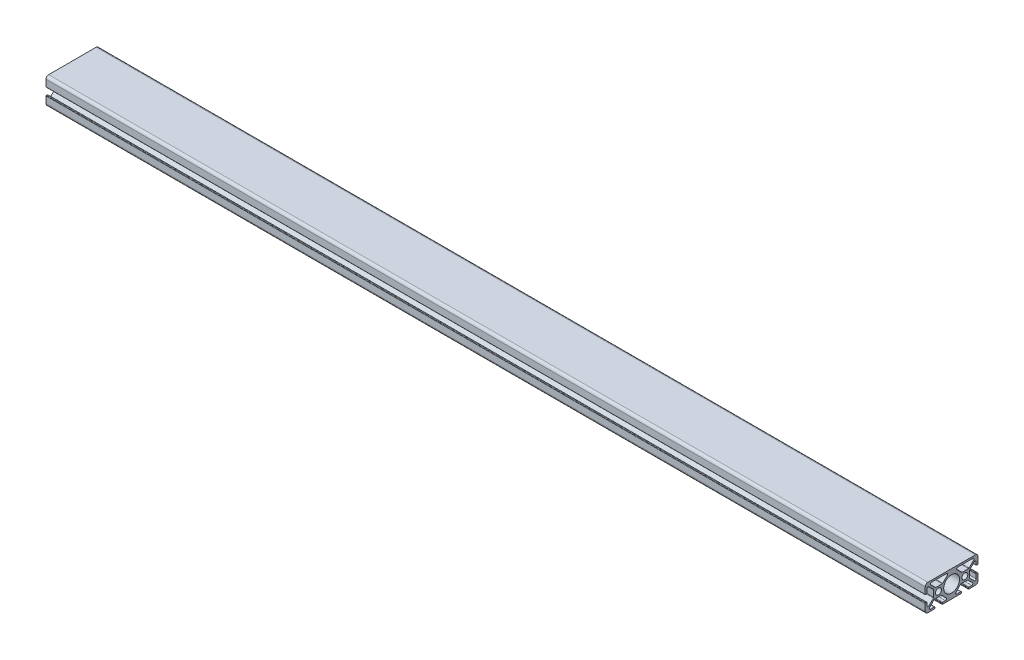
SolidWorks part; units mm, degrees
ref_plane "Ebene vorne" through (0, 0, 0) normal (0, 0, 1) x (1, 0, 0)
ref_plane "Ebene oben" through (0, 0, 0) normal (0, 1, 0) x (1, 0, 0)
ref_plane "Ebene rechts" through (0, 0, 0) normal (1, 0, 0) x (0, 0, -1)
sketch "Skizze1" plane through (0, 0, 0) normal (0, 1, 0) x (1, 0, 0)
  line L0 (0, 0) -> (1000, 0)
  dimension "D1" = 1000
other "Strukturbauteil1"
ref_plane "Ebene1" through (0, 0, 0) normal (1, 0, 0) x (0, 0, -1)
sketch "Model" plane through (0, 0, 0) normal (1, 0, 0) x (0, 0, -1)
  line L0 (25.0199, 10.7846) -> (19.9282, 5.6929)
  line L1 (19.2211, 5.4) -> (11.9789, 5.4)
  line L2 (11.2718, 5.6929) -> (6.1801, 10.7846)
  line L3 (-4.9801, 10.7846) -> (-10.0718, 5.6929)
  line L4 (-10.7789, 5.4) -> (-18.0211, 5.4)
  line L5 (-18.7282, 5.6929) -> (-23.8199, 10.7846)
  line L6 (-22.9023, 13) -> (-5.8977, 13)
  line L7 (7.0977, 13) -> (24.1023, 13)
  line L8 (-29.5, 4) -> (-28.5, 4)
  line L9 (-28, 4.5) -> (-28, 9.1023)
  line L10 (-25.7846, 10.0199) -> (-20.6929, 4.9282)
  line L11 (-20.4, 4.2211) -> (-20.4, -3.0211)
  line L12 (-20.6929, -3.7282) -> (-25.7846, -8.8199)
  line L13 (-28, -7.9023) -> (-28, -4.5)
  line L14 (-28.5, -4) -> (-29.5, -4)
  line L15 (-30, -4.5) -> (-30, -12)
  line L16 (-27, -15) -> (-19.5, -15)
  line L17 (-19, -14.5) -> (-19, -13.5)
  line L18 (-19.5, -13) -> (-24.1023, -13)
  line L19 (-25.0199, -10.7846) -> (-19.9282, -5.6929)
  line L20 (-19.2211, -5.4) -> (-11.9789, -5.4)
  line L21 (-11.2718, -5.6929) -> (-6.1801, -10.7846)
  line L22 (-7.0977, -13) -> (-10.5, -13)
  line L23 (-11, -13.5) -> (-11, -14.5)
  line L24 (-10.5, -15) -> (10.5, -15)
  line L25 (11, -14.5) -> (11, -13.5)
  line L26 (10.5, -13) -> (5.8977, -13)
  line L27 (4.9801, -10.7846) -> (10.0718, -5.6929)
  line L28 (10.7789, -5.4) -> (18.0211, -5.4)
  line L29 (18.7282, -5.6929) -> (23.8199, -10.7846)
  line L30 (22.9023, -13) -> (19.5, -13)
  line L31 (19, -13.5) -> (19, -14.5)
  line L32 (19.5, -15) -> (27, -15)
  line L33 (30, -12) -> (30, -4.5)
  line L34 (29.5, -4) -> (28.5, -4)
  line L35 (28, -4.5) -> (28, -9.1023)
  line L36 (25.7846, -10.0199) -> (20.6929, -4.9282)
  line L37 (20.4, -4.2211) -> (20.4, 3.0211)
  line L38 (20.6929, 3.7282) -> (25.7846, 8.8199)
  line L39 (28, 7.9023) -> (28, 4.5)
  line L40 (28.5, 4) -> (29.5, 4)
  line L41 (30, 4.5) -> (30, 12)
  line L42 (27, 15) -> (-27, 15)
  line L43 (-30, 12) -> (-30, 4.5)
  line L45 (-30, -15) -> (30, -15) construction
  line L46 (-30, -15) -> (-30, 15) construction
  line L47 (-30, 15) -> (30, 15) construction
  line L48 (30, -15) -> (30, 15) construction
  line L49 (-30, -15) -> (30, 15) construction
  line L50 (-30, 15) -> (30, -15) construction
  arc A0 (19.2211, 5.4) -> (19.9282, 5.6929) centre (19.2211, 6.4) ccw
  arc A1 (11.2718, 5.6929) -> (11.9789, 5.4) centre (11.9789, 6.4) ccw
  arc A2 (7.0977, 13) -> (6.1801, 10.7846) centre (7.0977, 11.7023) ccw
  arc A3 (-4.9801, 10.7846) -> (-5.8977, 13) centre (-5.8977, 11.7023) ccw
  arc A4 (-10.7789, 5.4) -> (-10.0718, 5.6929) centre (-10.7789, 6.4) ccw
  arc A5 (-18.7282, 5.6929) -> (-18.0211, 5.4) centre (-18.0211, 6.4) ccw
  arc A6 (-22.9023, 13) -> (-23.8199, 10.7846) centre (-22.9023, 11.7023) ccw
  circle A7 centre (-15, 0) radius 3.4
  circle A8 centre (15, 0) radius 3.4
  circle A9 centre (0, 0) radius 9
  arc A10 (25.0199, 10.7846) -> (24.1023, 13) centre (24.1023, 11.7023) ccw
  arc A11 (-30, 4.5) -> (-29.5, 4) centre (-29.5, 4.5) ccw
  arc A12 (-28.5, 4) -> (-28, 4.5) centre (-28.5, 4.5) ccw
  arc A13 (-25.7846, 10.0199) -> (-28, 9.1023) centre (-26.7023, 9.1023) ccw
  arc A14 (-20.4, 4.2211) -> (-20.6929, 4.9282) centre (-21.4, 4.2211) ccw
  arc A15 (-20.6929, -3.7282) -> (-20.4, -3.0211) centre (-21.4, -3.0211) ccw
  arc A16 (-28, -7.9023) -> (-25.7846, -8.8199) centre (-26.7023, -7.9023) ccw
  arc A17 (-28, -4.5) -> (-28.5, -4) centre (-28.5, -4.5) ccw
  arc A18 (-29.5, -4) -> (-30, -4.5) centre (-29.5, -4.5) ccw
  arc A19 (-30, -12) -> (-27, -15) centre (-27, -12) ccw
  arc A20 (-19.5, -15) -> (-19, -14.5) centre (-19.5, -14.5) ccw
  arc A21 (-19, -13.5) -> (-19.5, -13) centre (-19.5, -13.5) ccw
  arc A22 (-25.0199, -10.7846) -> (-24.1023, -13) centre (-24.1023, -11.7023) ccw
  arc A23 (-19.2211, -5.4) -> (-19.9282, -5.6929) centre (-19.2211, -6.4) ccw
  arc A24 (-11.2718, -5.6929) -> (-11.9789, -5.4) centre (-11.9789, -6.4) ccw
  arc A25 (-7.0977, -13) -> (-6.1801, -10.7846) centre (-7.0977, -11.7023) ccw
  arc A26 (-10.5, -13) -> (-11, -13.5) centre (-10.5, -13.5) ccw
  arc A27 (-11, -14.5) -> (-10.5, -15) centre (-10.5, -14.5) ccw
  arc A28 (10.5, -15) -> (11, -14.5) centre (10.5, -14.5) ccw
  arc A29 (11, -13.5) -> (10.5, -13) centre (10.5, -13.5) ccw
  arc A30 (4.9801, -10.7846) -> (5.8977, -13) centre (5.8977, -11.7023) ccw
  arc A31 (10.7789, -5.4) -> (10.0718, -5.6929) centre (10.7789, -6.4) ccw
  arc A32 (18.7282, -5.6929) -> (18.0211, -5.4) centre (18.0211, -6.4) ccw
  arc A33 (22.9023, -13) -> (23.8199, -10.7846) centre (22.9023, -11.7023) ccw
  arc A34 (19.5, -13) -> (19, -13.5) centre (19.5, -13.5) ccw
  arc A35 (19, -14.5) -> (19.5, -15) centre (19.5, -14.5) ccw
  arc A36 (27, -15) -> (30, -12) centre (27, -12) ccw
  arc A37 (30, -4.5) -> (29.5, -4) centre (29.5, -4.5) ccw
  arc A38 (28.5, -4) -> (28, -4.5) centre (28.5, -4.5) ccw
  arc A39 (25.7846, -10.0199) -> (28, -9.1023) centre (26.7023, -9.1023) ccw
  arc A40 (20.4, -4.2211) -> (20.6929, -4.9282) centre (21.4, -4.2211) ccw
  arc A41 (20.6929, 3.7282) -> (20.4, 3.0211) centre (21.4, 3.0211) ccw
  arc A42 (28, 7.9023) -> (25.7846, 8.8199) centre (26.7023, 7.9023) ccw
  arc A43 (28, 4.5) -> (28.5, 4) centre (28.5, 4.5) ccw
  arc A44 (29.5, 4) -> (30, 4.5) centre (29.5, 4.5) ccw
  arc A45 (30, 12) -> (27, 15) centre (27, 12) ccw
  arc A46 (-27, 15) -> (-30, 12) centre (-27, 12) ccw
  point P142 (0, 15)
  point P143 (-30, 0)
  point P144 (0, -15)
  point P145 (-15, -15)
  point P146 (15, -15)
  point P147 (30, 0)
  point P148 (0, 0)
